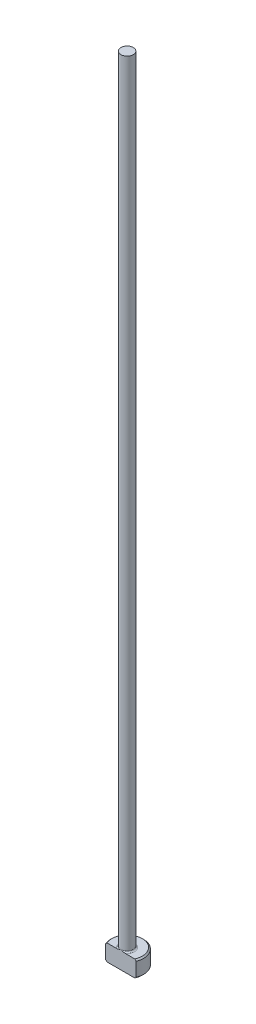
SolidWorks part; units mm, degrees
ref_plane "Front Plane" through (0, 0, 0) normal (0, 0, 1) x (1, 0, 0)
ref_plane "Top Plane" through (0, 0, 0) normal (0, 1, 0) x (1, 0, 0)
ref_plane "Right Plane" through (0, 0, 0) normal (1, 0, 0) x (0, 0, -1)
sketch "Sketch1" plane through (0, 0, 0) normal (0, 0, 1) x (1, 0, 0)
  line L0 (0, 259.9588) -> (0, -15.1925) construction
  line L1 (0, 0) -> (-3.175, 0)
  line L2 (-3.175, 0) -> (-3.175, 3.175)
  line L3 (-3.175, 3.175) -> (-1.19, 3.175)
  line L4 (-1.19, 3.175) -> (-1.19, 152.4)
  line L5 (-1.19, 152.4) -> (0, 152.4)
  line L6 (0, 152.4) -> (0, 0)
  dimension "L" = 152.4
  dimension "H" = 6.35
  dimension "T" = 3.175
  dimension "D" = 2.38
revolve "Revolve1" add sketch "Sketch1" angle 360 about L0
chamfer "Chamfer1" distance 0.254 angle 45 2 edges at (0, 3.175, 3.175) (0, 0, 3.175)
fillet "Fillet1" radius 0.254 1 edges at (0, 3.175, 1.19)
sketch "Sketch2" plane through (0, 0, 0) normal (0, 1, 0) x (1, 0, 0)
  line L0 (-2.9436, -1.19) -> (2.9436, -1.19)
  circle A0 centre (0, 0) radius 3.175 construction
  arc A1 (-2.9436, -1.19) -> (2.9436, -1.19) centre (0, 0) ccw
  circle A3 centre (0, 0) radius 1.19 construction
  dimension "D1" = 0
extrude "Key" cut sketch "Sketch2" along normal through all
sketch "Pocket Sketch" plane through (0, 0, 0) normal (0, 0, 1) x (1, 0, 0)
  line L0 (-3.5719, 0) -> (-3.5719, 3.2004)
  line L1 (-3.5719, 3.2004) -> (-2.1504, 3.2004)
  line L2 (-1.3884, 3.9624) -> (-1.3884, 22.225)
  line L3 (-1.3884, 22.225) -> (0, 22.225)
  line L4 (0, 22.225) -> (0, 0)
  line L5 (0, 0) -> (-3.5719, 0)
  line L6 (0, 12.6104) -> (0, -2.4989) construction
  line L7 (-3.175, 2.921) -> (-3.175, 0.254) construction
  line L8 (2.921, 3.175) -> (-2.921, 3.175) construction
  line L9 (-1.19, 152.4) -> (-1.19, 3.429) construction
  line L10 (-2.1504, 3.2004) -> (-1.3884, 3.9624)
  point P3 (-1.3884, 3.2004)
  dimension "D1" = 7.1437
  dimension "D2" = 0.3969
  dimension "D3" = 0.0254
  dimension "D4" = 0.1984
  dimension "D5" = 2.7769
  dimension "D6" = 22.225
